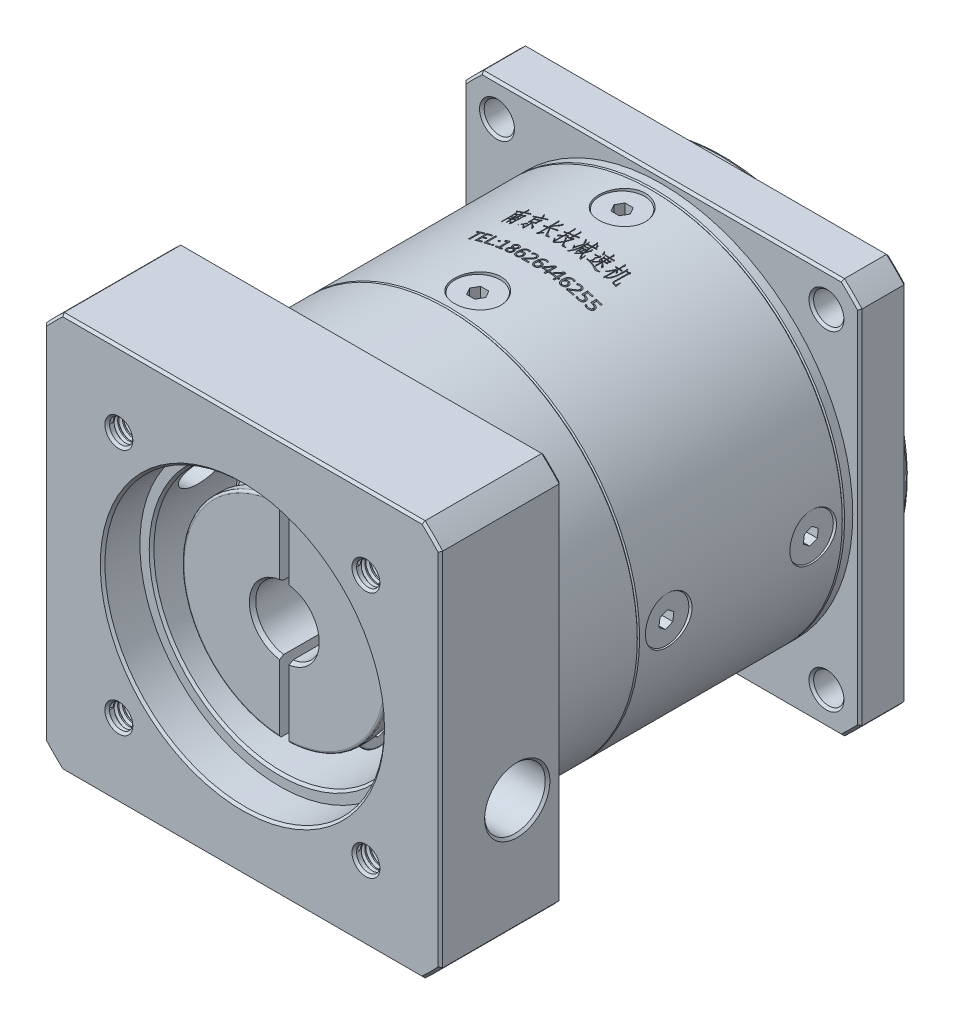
SolidWorks part; units mm, degrees
ref_plane "前视基准面" through (0, 0, 0) normal (0, 0, 1) x (1, 0, 0)
ref_plane "上视基准面" through (0, 0, 0) normal (0, 1, 0) x (1, 0, 0)
ref_plane "右视基准面" through (0, 0, 0) normal (1, 0, 0) x (0, 0, -1)
imported_body "14-60-75-M6-1-solid1"
imported_body "14-60-75-M6-1-solid2"
imported_body "14-60-75-M6-1-solid3"
imported_body "14-60-75-M6-1-solid4"
imported_body "ZF80-K15-L1-3-solid1"
imported_body "ZF80-K15-L1-3-solid2"
imported_body "ZF80-K15-L1-3-solid3"
imported_body "ZF80-K15-L1-3-solid4"
imported_body "ZF80-K15-L1-3-solid5"
imported_body "ZF80-K15-L1-3-solid6"
imported_body "ZF80-K15-L1-3-solid7"
imported_body "ZF80-K15-L1-3-solid8"
imported_body "ZF80-K15-L1-3-solid9"
sketch "草图1" plane through (0, 0, -47.2997) normal (0, 0, -1) x (-1, 0, 0)
  circle A0 centre (87.4858, 33.8036) radius 11.0409
  dimension "D1" = 22.0818
extrude "凸台-拉伸1" add sketch "草图1" along normal blind 5
